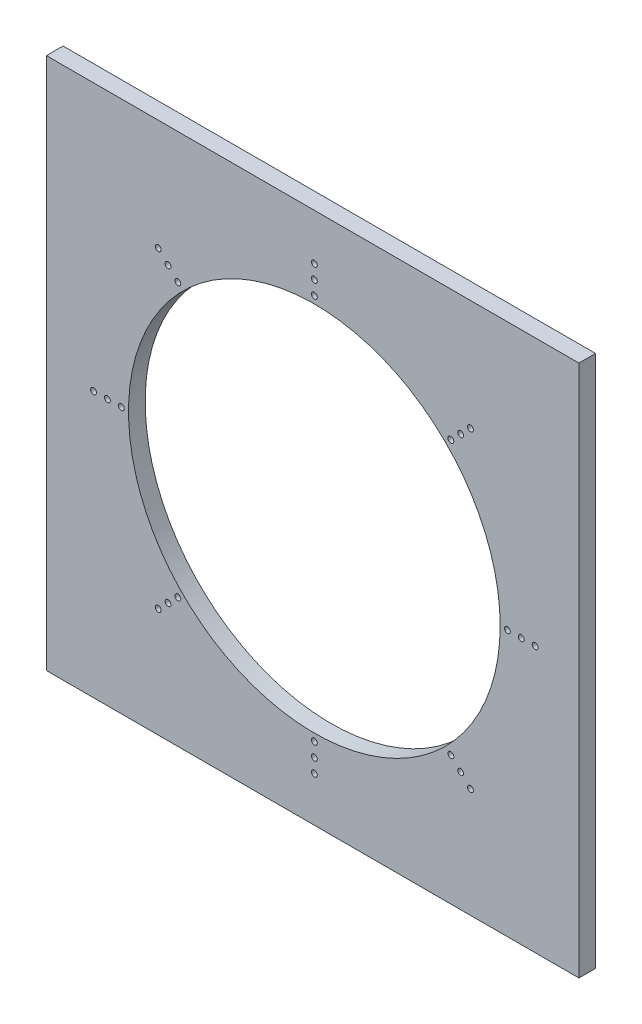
SolidWorks part; units mm, degrees
ref_plane "Front Plane" through (0, 0, 0) normal (0, 0, 1) x (1, 0, 0)
ref_plane "Top Plane" through (0, 0, 0) normal (0, 1, 0) x (1, 0, 0)
ref_plane "Right Plane" through (0, 0, 0) normal (1, 0, 0) x (0, 0, -1)
sketch "Sketch1" plane through (0, 0, 0) normal (0, 0, 1) x (1, 0, 0)
  line L1 (-304.8, 304.8) -> (304.8, 304.8)
  line L2 (-304.8, 304.8) -> (-304.8, -304.8)
  line L3 (-304.8, -304.8) -> (304.8, -304.8)
  line L4 (304.8, 304.8) -> (304.8, -304.8)
  line L5 (-304.8, 304.8) -> (304.8, -304.8) construction
  line L6 (-304.8, -304.8) -> (304.8, 304.8) construction
  point P0 (0, 0)
  dimension "D1" = 609.6
  dimension "D2" = 609.6
extrude "Boss-Extrude1" add sketch "Sketch1" along normal blind 19.05
sketch "Sketch2" plane through (0, 0, 19.05) normal (0, 0, 1) x (1, 0, 0)
  line L0 (1.9091, -0.7637) -> (1.9091, 220.2367) construction
  line L1 (158.18, 155.5072) -> (1.9091, -0.7637) construction
  circle A0 centre (1.9091, -0.7637) radius 212.725 construction
  circle A1 centre (1.9091, -0.7637) radius 266.7 construction
  circle A2 centre (1.9091, -0.7637) radius 221.0003 construction
  circle A3 centre (1.9091, 220.2367) radius 3.3655
  circle A4 centre (158.18, 155.5072) radius 3.3655
  circle A5 centre (222.9094, -0.7637) radius 3.3655
  circle A6 centre (158.18, -157.0345) radius 3.3655
  circle A7 centre (1.9091, -221.764) radius 3.3655
  circle A8 centre (-154.3617, -157.0345) radius 3.3655
  circle A9 centre (-219.0912, -0.7637) radius 3.3655
  circle A10 centre (-154.3617, 155.5072) radius 3.3655
  circle A11 centre (1.9091, -0.7637) radius 212.725
  point P21 (1.9091, -0.7637)
  dimension "D1" = 425.45
  dimension "D2" = 442.0006
  dimension "D3" = 6.731
  dimension "D5" = 425.45
  dimension "D4" = 45
extrude "Cut-Extrude1" cut sketch "Sketch2" against normal through all
sketch "Sketch3" plane through (0, 0, 0) normal (0, 0, -1) x (-1, 0, 0)
  circle A0 centre (-1.9091, 236.1117) radius 3.3655
  circle A1 centre (-1.9091, 251.9867) radius 3.3655
  dimension "D1" = 6.731
extrude "Cut-Extrude2" cut sketch "Sketch3" against normal through all
sketch "Sketch4" plane through (0, 0, 0) normal (0, 0, -1) x (-1, 0, 0)
  circle A0 centre (-1.9091, 251.9867) radius 5.5563
  circle A1 centre (-1.9091, 236.1117) radius 5.5562
  dimension "D1" = 11.1125
extrude "Cut-Extrude3" cut sketch "Sketch4" against normal blind 6.35
pattern_circular "CirPattern1" count 8 over 360 about axis through (1.9091, -0.7637, 0) along (0, 0, 1) of "Cut-Extrude3", "Cut-Extrude2"
